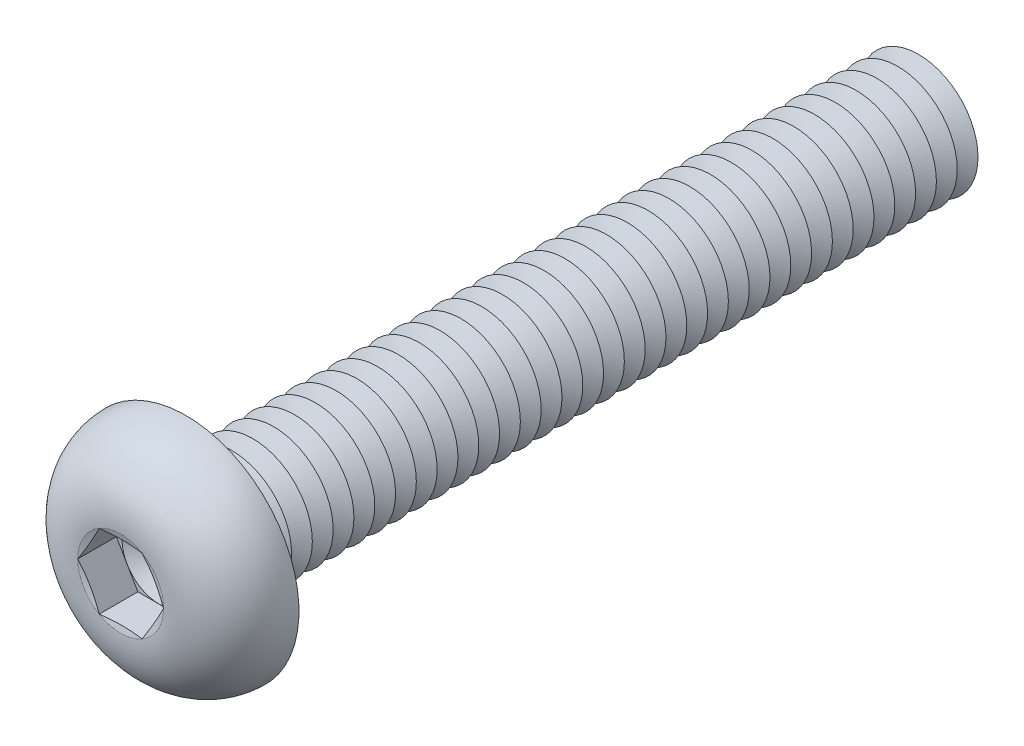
SolidWorks part; units mm, degrees
ref_plane "Front Plane" through (0, 0, 0) normal (0, 0, 1) x (1, 0, 0)
ref_plane "Top Plane" through (0, 0, 0) normal (0, 1, 0) x (1, 0, 0)
ref_plane "Right Plane" through (0, 0, 0) normal (1, 0, 0) x (0, 0, -1)
sketch "Sketch1" plane through (0, 0, 0) normal (1, 0, 0) x (0, 0, -1)
  line L0 (0, 2) -> (0, 3.8)
  line L3 (0, 2) -> (25, 2)
  line L4 (25, 2) -> (25, 0)
  line L5 (25, 0) -> (-2.2, 0) construction
  line L6 (-2.2, 0) -> (25, 0)
  line L7 (-2.2, 1.4434) -> (-2.2, 0.7217) construction
  line L8 (-2.2, 0.7217) -> (-2.2, 0)
  line L9 (-2.2, 1.4434) -> (-2.0066, 0.7217)
  line L10 (-2.0066, 0.7217) -> (-2.2, 0.7217)
  line L11 (25, 0) -> (22.7481, 0) construction
  line L12 (0, 3.8) -> (-2.2, 3.8) construction
  arc A1 (0, 3.8) -> (-2.2, 1.4434) centre (0, 1.5948) ccw
  point P8 (25, 1)
  dimension "D1" = 7.6
  dimension "D2" = 4
  dimension "D3" = 2.2
  dimension "D4" = 2.8868
  dimension "D5" = 25
  dimension "D6" = 15
revolve "Revolve1" add sketch "Sketch1" angle 360 about L5
fillet "Fillet1" radius 0.35 1 edges at (-2, 0, 0)
sketch "Sketch2" plane through (0, 0, 0) normal (1, 0, 0) x (0, 0, -1)
  line L0 (24.65, 2) -> (25.35, 2)
  line L1 (25, 2) -> (0.35, 2) construction
  line L2 (25.35, 2) -> (25, 1.3938)
  line L3 (25, -2) -> (25, 2) construction
  line L4 (25, 1.3938) -> (24.65, 2)
  dimension "D1" = 0.7
revolve "Cut-Revolve1" cut sketch "Sketch2" angle 360 about axis through (0, 0, -25) along (0, 0, -1)
pattern_linear "LPattern1" count 35 spacing 0.7 along (0, 0, 1) of "Cut-Revolve1"
sketch "Sketch3" plane through (0, 0, 2.2) normal (0, 0, 1) x (1, 0, 0)
  line L7 (0.7217, 1.25) -> (-0.7217, 1.25)
  line L8 (-0.7217, 1.25) -> (-1.4434, 0)
  line L9 (-1.4434, 0) -> (-0.7217, -1.25)
  line L10 (-0.7217, -1.25) -> (0.7217, -1.25)
  line L11 (0.7217, -1.25) -> (1.4434, 0)
  line L12 (1.4434, 0) -> (0.7217, 1.25)
  circle A0 centre (0, 0) radius 1.25 construction
  circle A3 centre (0, 0) radius 1.4434 construction
extrude "Cut-Extrude1" cut sketch "Sketch3" against normal blind 1.3
sketch "Sketch4" plane through (0, 0, 0.9) normal (0, 0, 1) x (1, 0, 0)
  line L1 (0.7217, 1.25) -> (-0.7217, 1.25) construction
  circle A0 centre (0, 0) radius 1.25
extrude "Cut-Extrude2" cut sketch "Sketch4" against normal through all draft 60
